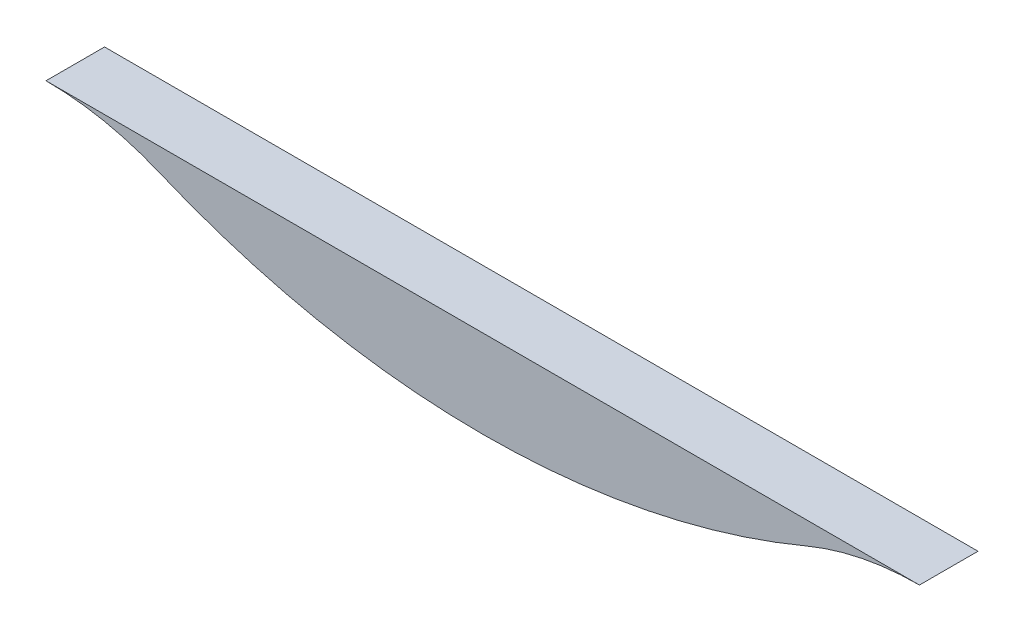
SolidWorks part; units mm, degrees
ref_plane "Plane1" through (0, 0, 0) normal (0, 0, 1) x (1, 0, 0)
ref_plane "Plane2" through (0, 0, 0) normal (0, 1, 0) x (1, 0, 0)
ref_plane "Plane3" through (0, 0, 0) normal (1, 0, 0) x (0, 0, -1)
sketch "Sketch1" plane through (0, 0, 0) normal (0, 0, 1) x (1, 0, 0)
  line L0 (-43.4634, 0) -> (43.4634, 0)
  line L1 (-43.4634, 0) -> (-43.4634, 6.7208)
  line L2 (43.4634, 6.7208) -> (-43.4634, 6.7208)
  line L3 (43.4634, 6.7208) -> (43.4634, 0)
  line L4 (50, 0) -> (-50, 0) construction
  line L5 (0, 0) -> (0, 6.7208) construction
extrude "Base-Extrude" add sketch "Sketch1" along normal mid plane 40
sketch "Sketch2" plane through (0, 0, 0) normal (0, 0, 1) x (1, 0, 0)
  line L0 (-43.4634, 0) -> (43.4634, 0) construction
  line L1 (0, -50) -> (0, 50) construction
  line L2 (-12.75, 0) -> (12.75, 0)
  arc A0 (-12.75, 0) -> (12.75, 0) centre (0, 25.5937) ccw
  dimension "D1" = 3
  dimension "D2" = 25.5
extrude "Boss-Extrude1" add sketch "Sketch2" along normal mid plane 2
fillet "Fillet1" radius 10 2 edges at (-12.75, 0, 0) (12.75, 0, 0)
sketch "Sketch3" plane through (43.4634, 0, 0) normal (1, 0, 0) x (0, 0, -1)
  line L4 (-20, 6.7208) -> (20, 6.7208)
  line L5 (-20, 6.7208) -> (-20, 0)
  line L6 (-20, 0) -> (20, 0)
  line L7 (20, 6.7208) -> (20, 0)
  line L8 (-20, 6.7208) -> (20, 6.7208)
  line L9 (-20, 6.7208) -> (-20, 0)
  line L10 (-20, 0) -> (20, 0)
  line L11 (20, 6.7208) -> (20, 0)
  dimension "D1" = 0
extrude "Cut-Extrude1" cut sketch "Sketch3" against normal through all
sketch "Orientation sketch" plane through (0, 0, 0) normal (0, 1, 0) x (-1, 0, 0)
  line L4 (14.9185, -1) -> (-14.9185, -1)
  line L5 (14.9185, -1) -> (14.9185, 1)
  line L6 (14.9185, 1) -> (-14.9185, 1)
  line L7 (-14.9185, 1) -> (-14.9185, -1)
  line L8 (14.9185, -1) -> (-14.9185, -1)
  line L9 (14.9185, -1) -> (14.9185, 1)
  line L10 (14.9185, 1) -> (-14.9185, 1)
  line L11 (-14.9185, 1) -> (-14.9185, -1)
  dimension "D1" = 0
